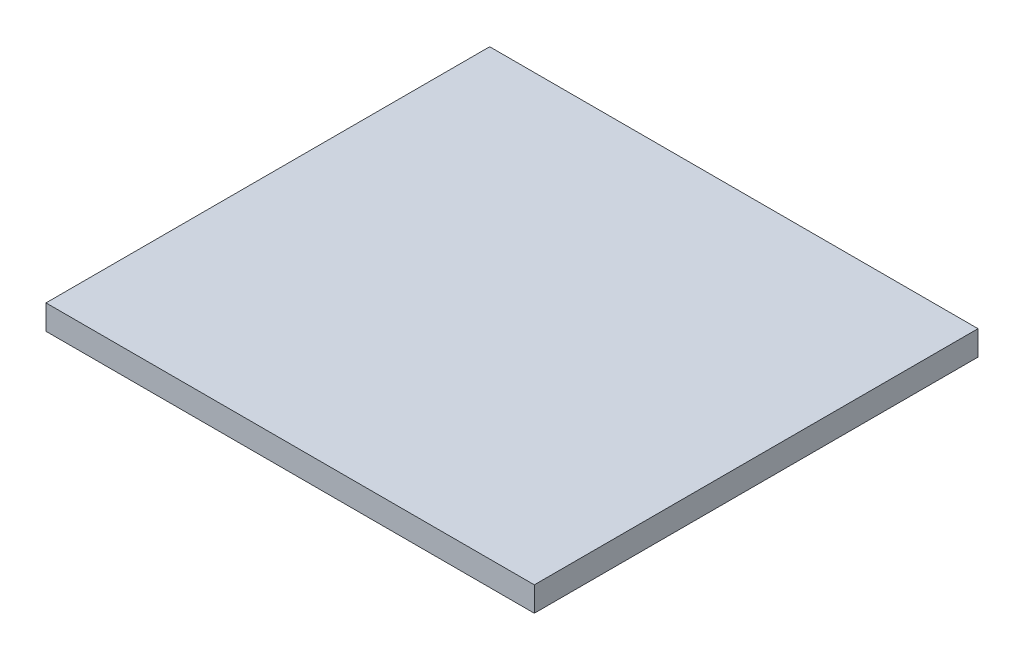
SolidWorks part; units mm, degrees
ref_plane "Front Plane" through (0, 0, 0) normal (0, 0, 1) x (1, 0, 0)
ref_plane "Top Plane" through (0, 0, 0) normal (0, 1, 0) x (1, 0, 0)
ref_plane "Right Plane" through (0, 0, 0) normal (1, 0, 0) x (0, 0, -1)
sketch "Sketch3" plane through (0, 0, 0) normal (0, 1, 0) x (1, 0, 0)
  line L1 (49.5449, -44.4305) -> (-49.5449, -44.4305)
  line L2 (49.5449, -44.4305) -> (49.5449, 45.598)
  line L3 (49.5449, 45.598) -> (-49.5449, 45.598)
  line L4 (-49.5449, -44.4305) -> (-49.5449, 45.598)
  line L5 (49.5449, -44.4305) -> (-49.5449, 45.598) construction
  line L6 (49.5449, 45.598) -> (-49.5449, -44.4305) construction
extrude "Boss-Extrude1" add sketch "Sketch3" along normal blind 5
sketch "Sketch4" plane through (0, 5, 0) normal (0, 1, 0) x (1, 0, 0)
  circle A0 centre (0, 0) radius 35
